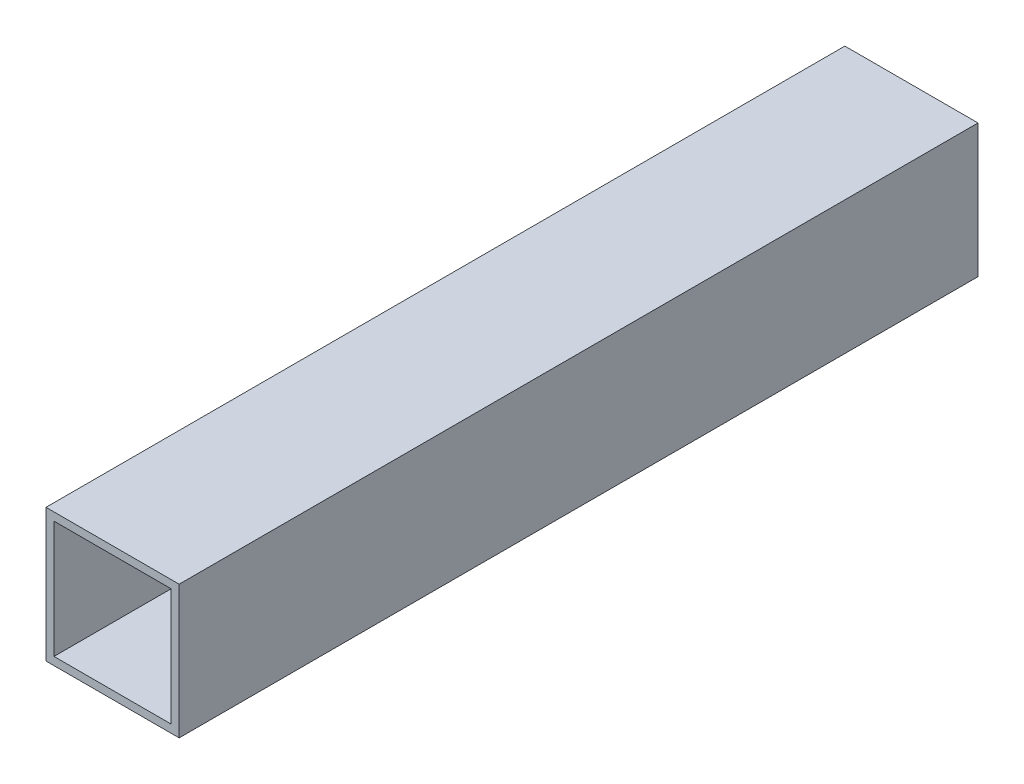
SolidWorks part; units mm, degrees
ref_plane "Спереди" through (0, 0, 0) normal (0, 0, 1) x (1, 0, 0)
ref_plane "Сверху" through (0, 0, 0) normal (0, 1, 0) x (1, 0, 0)
ref_plane "Справа" through (0, 0, 0) normal (1, 0, 0) x (0, 0, -1)
sketch "Эскиз1" plane through (0, 0, 0) normal (0, 0, 1) x (1, 0, 0)
  line L1 (-40.5, -44.7) -> (-18.5, -44.7)
  line L2 (-42, -43.2) -> (-17, -43.2)
  line L3 (-42, -43.2) -> (-42, -68.2)
  line L4 (-42, -68.2) -> (-17, -68.2)
  line L5 (-17, -43.2) -> (-17, -68.2)
  line L6 (-18.5, -44.7) -> (-18.5, -66.7)
  line L7 (-40.5, -66.7) -> (-18.5, -66.7)
  line L8 (-40.5, -44.7) -> (-40.5, -66.7)
  dimension "D1" = 25
  dimension "D3" = 1.5
extrude "Бобышка-Вытянуть1" add sketch "Эскиз1" against normal blind 150
